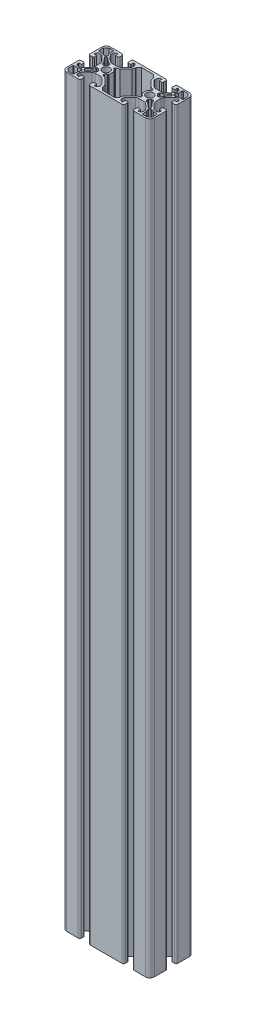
SolidWorks part; units mm, degrees
other "2018_08_28__13-15-45-812"
ref_plane "Ebene vorne" through (0, 0, 0) normal (0, 0, 1) x (1, 0, 0)
ref_plane "Ebene oben" through (0, 0, 0) normal (0, 1, 0) x (1, 0, 0)
ref_plane "Ebene rechts" through (0, 0, 0) normal (1, 0, 0) x (0, 0, -1)
imported_body "Importiert1"
sketch "Skizze1" plane through (0, 1500, 0) normal (0, 1, 0) x (1, 0, 0)
  line L1 (-42.1729, 21.5096) -> (46.3623, 21.5096)
  line L2 (-42.1729, 21.5096) -> (-42.1729, -27.1691)
  line L3 (-42.1729, -27.1691) -> (46.3623, -27.1691)
  line L4 (46.3623, 21.5096) -> (46.3623, -27.1691)
extrude "Schnitt-Linear austragen1" cut sketch "Skizze1" against normal offset from surface (2320 mm away) 680
